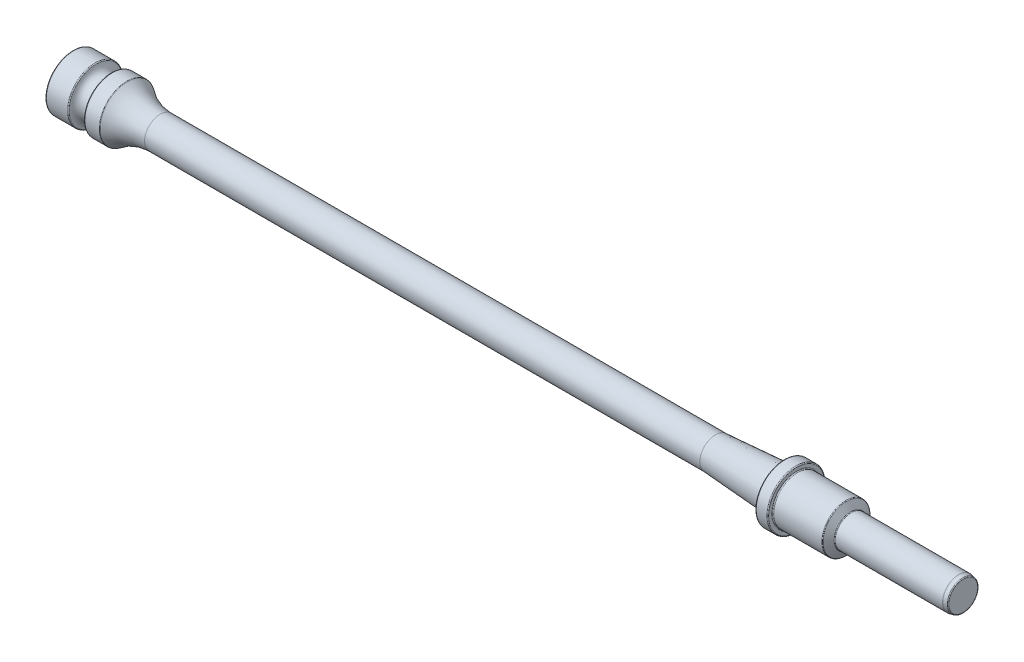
SolidWorks part; units mm, degrees
ref_plane "Front Plane" through (0, 0, 0) normal (0, 0, 1) x (1, 0, 0)
ref_plane "Top Plane" through (0, 0, 0) normal (0, 1, 0) x (1, 0, 0)
ref_plane "Right Plane" through (0, 0, 0) normal (1, 0, 0) x (0, 0, -1)
sketch "Sketch1" plane through (0, 0, 0) normal (0, 0, 1) x (1, 0, 0)
  line L0 (0, 0) -> (194, 0) construction
  line L1 (19, 3.4) -> (139.9933, 3.4)
  line L2 (194, 0) -> (194, 3.136)
  line L3 (0, 0) -> (0, 5.8)
  line L4 (0.2, 6) -> (4.8106, 6)
  line L5 (192.9802, 3.5) -> (169.6144, 3.5)
  line L6 (168.3856, 5.2) -> (157.9, 5.2)
  line L7 (169.442, 3.5986) -> (168.558, 5.1014)
  line L8 (8.5894, 6) -> (11.7281, 6)
  line L9 (193.0194, 3.4961) -> (193.8392, 3.3322)
  line L10 (140.0066, 3.4004) -> (154.8133, 4.3876)
  line L11 (0, 0) -> (194, 0)
  line L12 (155, 4.5871) -> (155, 6.1)
  line L13 (155.2, 6.3) -> (157.5, 6.3)
  line L14 (157.7, 5.4) -> (157.7, 6.1)
  arc A0 (5.0094, 5.8211) -> (8.3906, 5.8211) centre (6.7, 6) ccw
  arc A1 (19, 3.4) -> (11.8549, 5.9547) centre (19, 14.6692) cw
  arc A2 (11.7281, 6) -> (11.8549, 5.9547) centre (11.7281, 5.8) cw
  arc A3 (4.8106, 6) -> (5.0094, 5.8211) centre (4.8106, 5.8) cw
  arc A4 (8.3906, 5.8211) -> (8.5894, 6) centre (8.5894, 5.8) cw
  arc A5 (193.8392, 3.3322) -> (194, 3.136) centre (193.8, 3.136) cw
  arc A6 (193.0194, 3.4961) -> (192.9802, 3.5) centre (192.9802, 3.3) ccw
  arc A7 (154.8133, 4.3876) -> (155, 4.5871) centre (154.8, 4.5871) ccw
  arc A8 (169.6144, 3.5) -> (169.442, 3.5986) centre (169.6144, 3.7) cw
  arc A9 (157.9, 5.2) -> (157.7, 5.4) centre (157.9, 5.4) cw
  arc A10 (139.9933, 3.4) -> (140.0066, 3.4004) centre (139.9933, 3.6) ccw
  arc A11 (0, 5.8) -> (0.2, 6) centre (0.2, 5.8) cw
  arc A12 (168.3856, 5.2) -> (168.558, 5.1014) centre (168.3856, 5) cw
  arc A13 (155, 6.1) -> (155.2, 6.3) centre (155.2, 6.1) cw
  arc A14 (157.5, 6.3) -> (157.7, 6.1) centre (157.5, 6.1) cw
  point P16 (5, 6)
  point P19 (8.4, 6)
  point P26 (194, 3.3)
  point P29 (193, 3.5)
  point P32 (168.5, 5.2)
  point P35 (169.5, 3.5)
  point P41 (155, 4.4)
  point P44 (140, 3.4)
  point P47 (0, 6)
  point P50 (168.5, 5.2)
  point P53 (155, 6.3)
  point P56 (157.7, 6.3)
  dimension "D7" = 1.7
  dimension "D5" = 0.2
  dimension "D10" = 0.2
  dimension "D13" = 0.2
  dimension "D19" = 8.8
  dimension "D23" = 0.2
  dimension "D24" = 0.2
  dimension "D25" = 0.2
  dimension "D26" = 0.2
  dimension "D27" = 0.2
  dimension "D1" = 194
  dimension "D2" = 12
  dimension "D3" = 5
  dimension "D4" = 12
  dimension "D6" = 8.4
  dimension "D8" = 6.8
  dimension "D9" = 19
  dimension "D11" = 54
  dimension "D12" = 7
  dimension "D14" = 10.4
  dimension "D15" = 25.5
  dimension "D16" = 1
  dimension "D17" = 6.6
  dimension "D18" = 24.5
  dimension "D20" = 39
  dimension "D21" = 2.7
  dimension "D22" = 12.6
revolve "Revolve1" add sketch "Sketch1" angle 360 about L0
